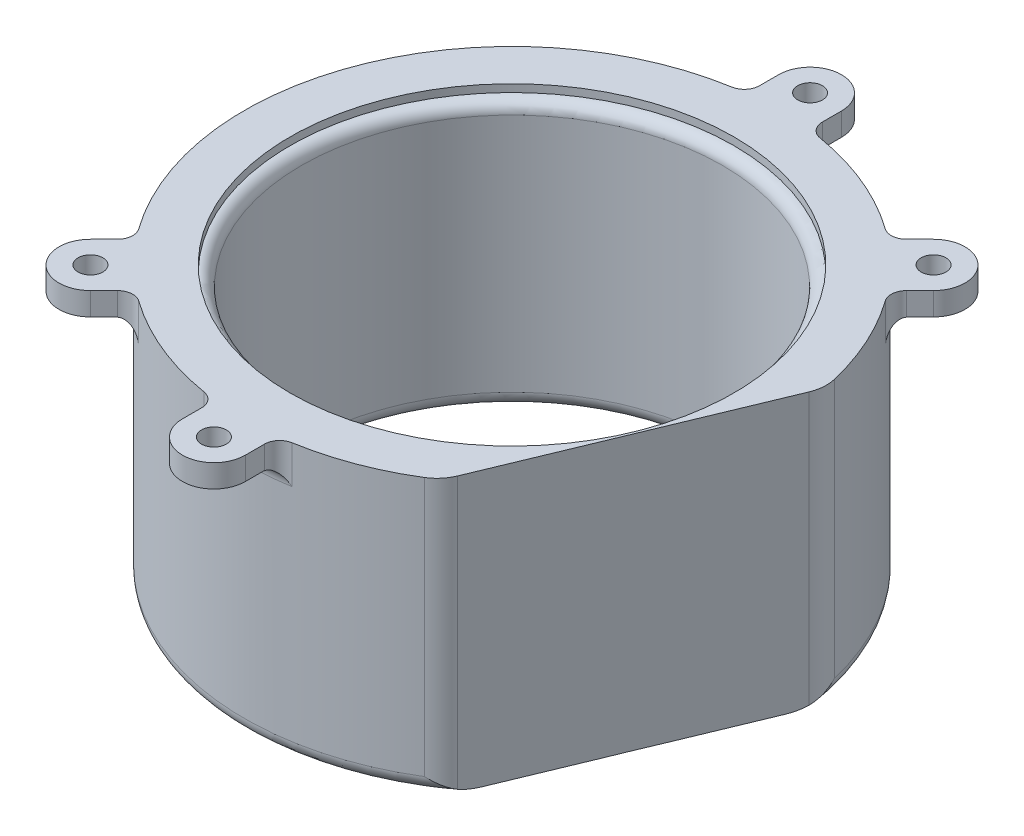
SolidWorks part; units mm, degrees
ref_plane "Front" through (0, 0, 0) normal (0, 0, 1) x (1, 0, 0)
ref_plane "Top" through (0, 0, 0) normal (0, 1, 0) x (1, 0, 0)
ref_plane "Right" through (0, 0, 0) normal (1, 0, 0) x (0, 0, -1)
sketch "Sketch1" plane through (0, 0, 0) normal (0, 1, 0) x (1, 0, 0)
  circle A0 centre (0, 0) radius 27.625
  circle A1 centre (0, 0) radius 35.125
  dimension "D1" = 55.25
  dimension "D2" = 7.5
extrude "Boss-Extrude1" add sketch "Sketch1" along normal mid plane 36
sketch "Sketch2" plane through (0, 18, 0) normal (0, 1, 0) x (1, 0, 0)
  circle A0 centre (0, 0) radius 29.125
  dimension "D1" = 58.25
extrude "Cut-Extrude1" cut sketch "Sketch2" against normal blind 1
fillet "Fillet1" radius 1.5 1 edges at (0, 17, 27.625)
sketch "Sketch3" plane through (0, 18, 0) normal (0, 1, 0) x (1, 0, 0)
  line L0 (0, 39.125) -> (0, 35.125) construction
  line L1 (4.125, 39.125) -> (4.125, 34.8819)
  line L2 (-4.125, 39.125) -> (-4.125, 34.8819)
  circle A0 centre (0, 39.125) radius 1.625
  circle A1 centre (0, 0) radius 35.125 construction
  circle A2 centre (0, 39.125) radius 4.125
  circle A3 centre (0, 0) radius 35.125
  dimension "D1" = 3.25
  dimension "D2" = 4
  dimension "D3" = 2.5
extrude "Boss-Extrude2" add sketch "Sketch3" against normal blind 3
pattern_circular "CirPattern1" count 8 over 360 about axis through (0, 0, 0) along (0, 1, 0) of "Boss-Extrude2"
fillet "Fillet4" radius 2 2 edges at (0, -18, 27.625) (0, -18, 35.125)
sketch "Sketch4" plane through (0, 18, 0) normal (0, 1, 0) x (1, 0, 0)
  line L0 (-27.6656, -27.6656) -> (27.6656, 27.6656) construction
  line L1 (0, 39.125) -> (0, -39.125) construction
  circle A0 centre (0, 0) radius 39.125 construction
  dimension "D1" = 78.25
fillet "Fillet5" radius 2 8 edges at (-4.125, 16.5, -34.8819) (4.125, 16.5, -34.8819) (21.7484, 16.5, -27.5821) (4.125, 16.5, 34.8819) (-4.125, 16.5, 34.8819) (-21.7484, 16.5, 27.5821) (-27.5821, 16.5, 21.7484) (27.5821, 16.5, -21.7484)
fillet "Fillet6" radius 2 12 edges at (-4.5986, 15, -35.324) (4.5986, 15, -35.324) (21.7261, 15, -28.2295) (4.5986, 15, 35.324) (-4.5986, 15, 35.324) (-21.7261, 15, 28.2295) (-28.2295, 15, 21.7261) (28.2295, 15, -21.7261) (0, 15, -35.125) (24.8371, 15, -24.8371) (0, 15, 35.125) (-24.8371, 15, 24.8371)
sketch "Sketch5" plane through (0, 18, 0) normal (0, 1, 0) x (1, 0, 0)
  line L0 (0, -39.125) -> (27.6656, 27.6656) construction
  line L1 (13.8328, -5.7297) -> (27.1713, -11.2547) construction
  line L2 (27.1713, -11.2547) -> (32.4513, -13.4418) construction
  line L3 (19.822, -28.9975) -> (34.5206, 6.488)
  line L12 (-4.125, 39.125) -> (-4.125, 36.6163)
  line L13 (-28.8084, -22.9748) -> (-30.5824, -24.7487)
  line L14 (-24.7487, -30.5824) -> (-22.9748, -28.8084)
  line L15 (-4.125, -36.6163) -> (-4.125, -39.125)
  line L16 (4.125, -39.125) -> (4.125, -36.6163)
  line L17 (28.8084, 22.9748) -> (30.5824, 24.7487)
  line L18 (24.7487, 30.5824) -> (22.9748, 28.8084)
  line L19 (4.125, 36.6163) -> (4.125, 39.125)
  line L20 (-4.125, 39.125) -> (-4.125, 36.6163)
  line L21 (-28.8084, -22.9748) -> (-30.5824, -24.7487)
  line L22 (-24.7487, -30.5824) -> (-22.9748, -28.8084)
  line L23 (-4.125, -36.6163) -> (-4.125, -39.125)
  line L24 (4.125, -39.125) -> (4.125, -36.6163)
  line L25 (28.8084, 22.9748) -> (30.5824, 24.7487)
  line L26 (24.7487, 30.5824) -> (22.9748, 28.8084)
  line L27 (4.125, 36.6163) -> (4.125, 39.125)
  arc A0 (5.795, -34.6437) -> (28.5945, 20.3991) centre (0, 0) ccw construction
  arc A17 (-5.795, 34.6437) -> (-4.125, 36.6163) centre (-6.125, 36.6163) ccw
  arc A18 (-5.795, 34.6437) -> (-28.5945, -20.3991) centre (0, 0) ccw
  arc A19 (-28.8084, -22.9748) -> (-28.5945, -20.3991) centre (-30.2226, -21.5606) ccw
  arc A20 (-30.5824, -24.7487) -> (-24.7487, -30.5824) centre (-27.6656, -27.6656) ccw
  arc A21 (-20.3991, -28.5945) -> (-22.9748, -28.8084) centre (-21.5606, -30.2226) ccw
  arc A22 (-20.3991, -28.5945) -> (-5.795, -34.6437) centre (0, 0) ccw
  arc A23 (-4.125, -36.6163) -> (-5.795, -34.6437) centre (-6.125, -36.6163) ccw
  arc A24 (-4.125, -39.125) -> (4.125, -39.125) centre (0, -39.125) ccw
  arc A25 (5.795, -34.6437) -> (4.125, -36.6163) centre (6.125, -36.6163) ccw
  arc A26 (5.795, -34.6437) -> (28.5945, 20.3991) centre (0, 0) ccw
  arc A27 (28.8084, 22.9748) -> (28.5945, 20.3991) centre (30.2226, 21.5606) ccw
  arc A28 (30.5824, 24.7487) -> (24.7487, 30.5824) centre (27.6656, 27.6656) ccw
  arc A29 (20.3991, 28.5945) -> (22.9748, 28.8084) centre (21.5606, 30.2226) ccw
  arc A30 (20.3991, 28.5945) -> (5.795, 34.6437) centre (0, 0) ccw
  arc A31 (4.125, 36.6163) -> (5.795, 34.6437) centre (6.125, 36.6163) ccw
  arc A32 (4.125, 39.125) -> (-4.125, 39.125) centre (0, 39.125) ccw
  arc A33 (-5.795, 34.6437) -> (-4.125, 36.6163) centre (-6.125, 36.6163) ccw
  arc A34 (-5.795, 34.6437) -> (-28.5945, -20.3991) centre (0, 0) ccw
  arc A35 (-28.8084, -22.9748) -> (-28.5945, -20.3991) centre (-30.2226, -21.5606) ccw
  arc A36 (-30.5824, -24.7487) -> (-24.7487, -30.5824) centre (-27.6656, -27.6656) ccw
  arc A37 (-20.3991, -28.5945) -> (-22.9748, -28.8084) centre (-21.5606, -30.2226) ccw
  arc A38 (-20.3991, -28.5945) -> (-5.795, -34.6437) centre (0, 0) ccw
  arc A39 (-4.125, -36.6163) -> (-5.795, -34.6437) centre (-6.125, -36.6163) ccw
  arc A40 (-4.125, -39.125) -> (4.125, -39.125) centre (0, -39.125) ccw
  arc A41 (5.795, -34.6437) -> (4.125, -36.6163) centre (6.125, -36.6163) ccw
  arc A42 (5.795, -34.6437) -> (28.5945, 20.3991) centre (0, 0) ccw
  arc A43 (28.8084, 22.9748) -> (28.5945, 20.3991) centre (30.2226, 21.5606) ccw
  arc A44 (30.5824, 24.7487) -> (24.7487, 30.5824) centre (27.6656, 27.6656) ccw
  arc A45 (20.3991, 28.5945) -> (22.9748, 28.8084) centre (21.5606, 30.2226) ccw
  arc A46 (20.3991, 28.5945) -> (5.795, 34.6437) centre (0, 0) ccw
  arc A47 (4.125, 36.6163) -> (5.795, 34.6437) centre (6.125, 36.6163) ccw
  arc A48 (4.125, 39.125) -> (-4.125, 39.125) centre (0, 39.125) ccw
  point P13 (27.1713, -11.2547)
  dimension "D1" = 5.715
  dimension "D2" = 0
extrude "Cut-Extrude2" cut sketch "Sketch5" against normal through all both and the other way through all contours L3 M44
fillet "Fillet7" radius 5 2 edges
